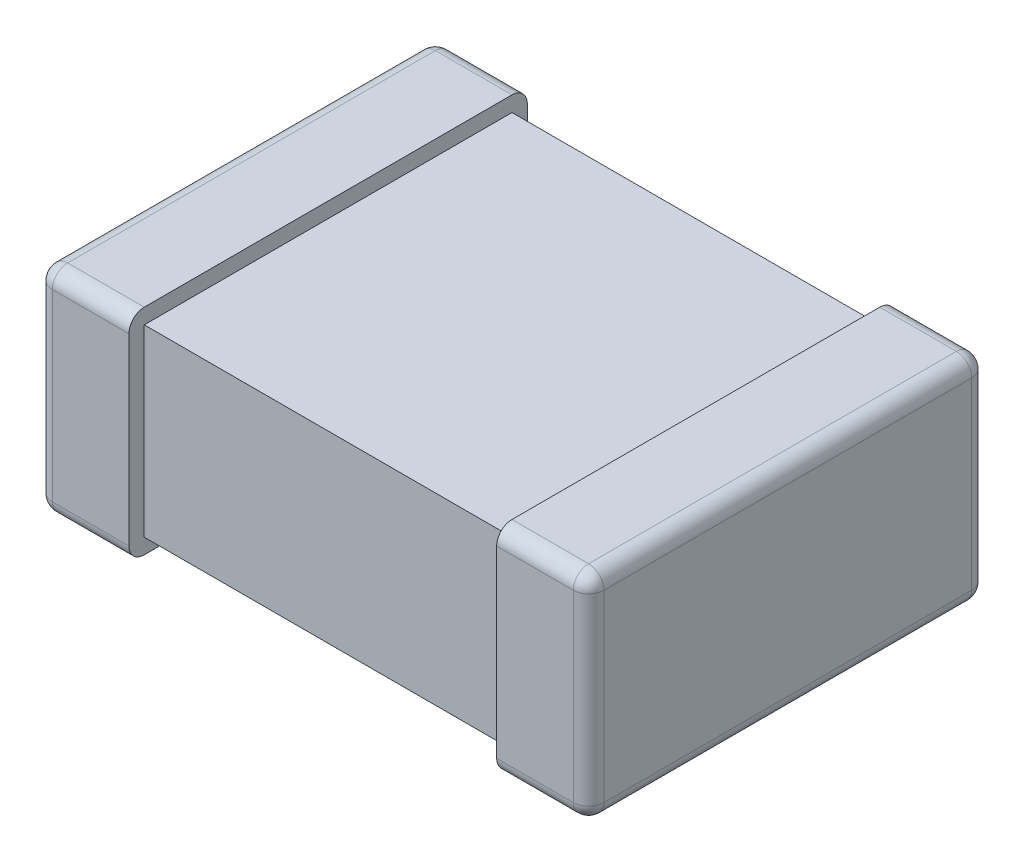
SolidWorks part; units mm, degrees
ref_plane "Front Plane" through (0, 0, 0) normal (0, 0, 1) x (1, 0, 0)
ref_plane "Top Plane" through (0, 0, 0) normal (0, 1, 0) x (1, 0, 0)
ref_plane "Right Plane" through (0, 0, 0) normal (1, 0, 0) x (0, 0, -1)
sketch "Sketch1" plane through (0, 0, 0) normal (0, 1, 0) x (1, 0, 0)
  line L1 (-1.524, -1.524) -> (1.524, -1.524)
  line L2 (-1.524, -1.524) -> (-1.524, 1.524)
  line L3 (-1.524, 1.524) -> (1.524, 1.524)
  line L4 (1.524, -1.524) -> (1.524, 1.524)
  line L5 (-1.524, -1.524) -> (1.524, 1.524) construction
  line L6 (-1.524, 1.524) -> (1.524, -1.524) construction
  point P0 (0, 0)
extrude "Boss-Extrude1" add sketch "Sketch1" along normal blind 1.524
sketch "Sketch3" plane through (-1.524, 0, 0) normal (-1, 0, 0) x (0, 0, 1)
  line L4 (-1.651, -0.127) -> (1.651, -0.127)
  line L5 (-1.651, -0.127) -> (-1.651, 1.651)
  line L6 (-1.651, 1.651) -> (1.651, 1.651)
  line L7 (1.651, -0.127) -> (1.651, 1.651)
  line L8 (-1.651, -0.127) -> (1.651, 1.651) construction
  line L9 (-1.651, 1.651) -> (1.651, -0.127) construction
  point P6 (0, 0.762)
extrude "Boss-Extrude2" add sketch "Sketch3" along normal blind 0.762
sketch "Sketch4" plane through (1.524, 0, 0) normal (1, 0, 0) x (0, 0, -1)
  line L4 (-1.651, -0.127) -> (1.651, -0.127)
  line L5 (-1.651, -0.127) -> (-1.651, 1.651)
  line L6 (-1.651, 1.651) -> (1.651, 1.651)
  line L7 (1.651, -0.127) -> (1.651, 1.651)
  line L8 (-1.651, -0.127) -> (1.651, 1.651) construction
  line L9 (-1.651, 1.651) -> (1.651, -0.127) construction
  point P6 (0, 0.762)
extrude "Boss-Extrude3" add sketch "Sketch4" along normal blind 0.762
fillet "Fillet1" radius 0.127 16 edges at (-2.286, -0.127, 0) (-2.286, 1.651, 0) (-2.286, 0.762, 1.651) (-2.286, 0.762, -1.651) (2.286, 0.762, 1.651) (2.286, -0.127, 0) (2.286, 0.762, -1.651) (2.286, 1.651, 0) (1.905, -0.127, -1.651) (-1.905, -0.127, -1.651) (1.905, 1.651, -1.651) (-1.905, 1.651, -1.651) (-1.905, -0.127, 1.651) (1.905, -0.127, 1.651) (1.905, 1.651, 1.651) (-1.905, 1.651, 1.651)
